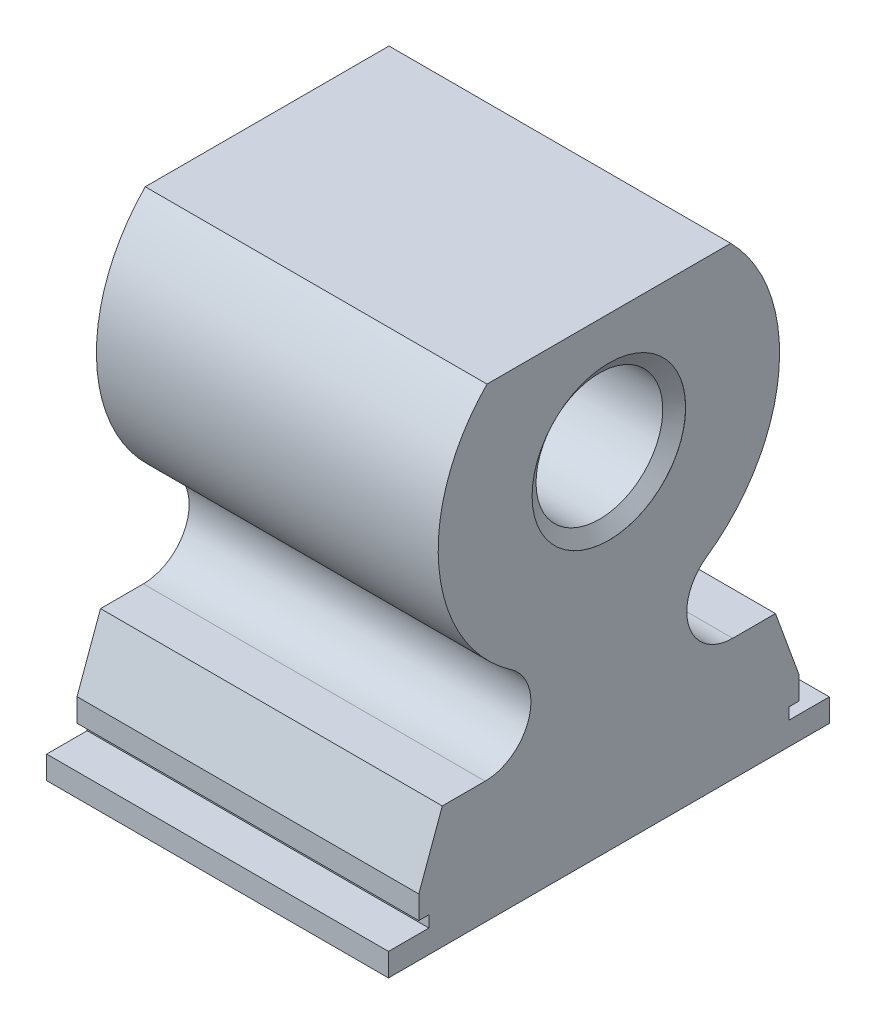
SolidWorks part; units mm, degrees
ref_plane "Plane1" through (0, 0, 0) normal (0, 0, 1) x (1, 0, 0)
ref_plane "Plane2" through (0, 0, 0) normal (0, 1, 0) x (1, 0, 0)
ref_plane "Plane3" through (0, 0, 0) normal (1, 0, 0) x (0, 0, -1)
sketch "BodySke" plane through (0, 0, 0) normal (1, 0, 0) x (0, 0, -1)
  line L0 (-5.74, -9) -> (5.74, -9)
  line L1 (5.74, -9) -> (5.74, -8.4)
  line L2 (5.74, -8.4) -> (4.6867, -8.4)
  line L3 (-5.74, -9) -> (-5.74, -8.4)
  line L4 (-5.74, -8.4) -> (-4.6867, -8.4)
  line L5 (4.6867, -8.4) -> (4.6867, -8.1)
  line L6 (-4.6867, -8.4) -> (-4.6867, -8.1)
  line L7 (4.6867, -8.1) -> (4.95, -8.1)
  line L8 (-4.6867, -8.1) -> (-4.95, -8.1)
  line L9 (-3.2237, -5.82) -> (-4.3385, -5.82)
  line L10 (0, -0.7) -> (4.5045, -0.7) construction
  line L11 (4.3385, -5.82) -> (3.2237, -5.82)
  line L12 (0, 7.62) -> (0, -11.43) construction
  line L13 (7.62, 0) -> (-7.62, 0) construction
  line L14 (2.03, -2.8908) -> (2.03, -7.62) construction
  line L15 (-2.03, -2.8908) -> (-2.03, -7.62) construction
  line L16 (4.3385, -5.82) -> (4.95, -7.5)
  line L17 (4.95, -7.5) -> (4.95, -8.1)
  line L18 (-4.3385, -5.82) -> (-4.95, -7.5)
  line L19 (-4.95, -7.5) -> (-4.95, -8.1)
  circle A0 centre (0, 0) radius 1.65
  arc A1 (2.5412, -3.6469) -> (-2.5412, -3.6469) centre (0, 0) ccw
  arc A2 (3.2237, -5.82) -> (2.5412, -3.6469) centre (3.2237, -4.6263) cw
  arc A3 (-2.5412, -3.6469) -> (-3.2237, -5.82) centre (-3.2237, -4.6263) cw
  dimension "Thread_min" = 3.3
  dimension "C_dia" = 8.89
  dimension "J_dim" = 4.06
  dimension "E_dim" = 11.48
  dimension "D_dim" = 3.18
  dimension "Clinch_ht" = 0.6
  dimension "Side_ht" = 0.6
  dimension "Groove_wid" = 0.3
  dimension "A_dim" = 9.9
  dimension "Groove_overall" = 9.3733
  dimension "F_dim" = 9
  dimension "D12" = 20
  dimension "Advance" = 0.7
extrude "Body" add sketch "BodySke" along normal blind 8.9
revolve "EndChamfer" cut sketch "EndChamferSke" angle 360 about L11
sketch "EndChamferSke" plane through (0, 0, 0) normal (0, 0, 1) x (1, 0, 0)
  line L0 (-0.254, 2) -> (0.0025, 2)
  line L2 (0.0025, 2) -> (0.2475, 1.65)
  line L3 (0.2475, 1.65) -> (-0.254, 1.65)
  line L4 (-0.254, 1.65) -> (-0.254, 2)
  line L5 (9.154, 2) -> (8.8975, 2)
  line L6 (8.8975, 2) -> (8.6525, 1.65)
  line L7 (8.6525, 1.65) -> (9.154, 1.65)
  line L8 (9.154, 1.65) -> (9.154, 2)
  line L9 (0, 4.445) -> (0, -3.6469) construction
  line L10 (8.9, -3.6469) -> (8.9, 4.445) construction
  line L11 (-5.1059, 0) -> (14.0173, 0) construction
  line L12 (8.9, 0) -> (0, 0) construction
  dimension "Inset" = 0.0025
  dimension "D2" = 34.99
  dimension "Inset_far" = 0.0025
  dimension "D3" = 0.254
  dimension "D4" = 0.254
  dimension "Thread_min" = 3.3
  dimension "Thread_nominal" = 4
sketch "ThdSchSke" [suppressed] plane through (0, 0, 0) normal (0, 0, 1) x (1, 0, 0)
  line L0 (-1.2331, 0) -> (11.43, 0) construction
  line L1 (6.0414, 0) -> (0.207, 0) construction
  line L2 (0.0025, 1.7272) -> (0.0025, -1.4224) construction
  line L3 (0.0025, -1.4224) -> (0.2071, -1.1303)
  line L4 (0.207, -1.1303) -> (6.0414, -1.1303) construction
  line L5 (0.0025, -1.4224) -> (-0.202, -1.1303)
  line L6 (-0.202, -1.1303) -> (0.2071, -1.1303)
  line L8 (0.0025, 1.4224) -> (0.0025, -1.4224) construction
  dimension "Vee_angle" = 70
  dimension "Thread_nominal" = 4
revolve "ThreadSchematic" [suppressed] cut sketch "ThdSchSke" angle 360 about L0
pattern_linear "ThdSchPat" [suppressed]
sketch "TopCutSke" plane through (0, 0, 0) normal (-1, 0, 0) x (0, 0, 1)
  line L0 (0, 0) -> (0, 6.35) construction
  line L1 (-4.445, 3.1115) -> (4.445, 3.1115)
  line L2 (-4.445, 3.1115) -> (-4.445, 12.0015)
  line L3 (-4.445, 12.0015) -> (4.445, 12.0015)
  line L4 (4.445, 3.1115) -> (4.445, 12.0015)
  dimension "Width" = 8.89
  dimension "Offset" = 3.1115
extrude "TopCut" cut sketch "TopCutSke" against normal blind 8.9
equation "' \"Length@Body\" = 8.9"
equation "' \"A_dim@BodySke\" = 9.9"
equation "' \"C_dia@BodySke\" = 8.89"
equation "' \"D_dim@BodySke\" = 3.18"
equation "' \"E_dim@BodySke\" = 11.48"
equation "' \"F_dim@BodySke\" = 9"
equation "' \"J_dim@BodySke\" =  4.06"
equation "' \"Advance@BodySke\" = 0.7"
equation "' \"Thread_min@BodySke\" = 3.3"
equation "' \"Thread_nominal@ThreadCosmetic\" = 4"
equation "\"Width@TopCutSke\" = \"C_dia@BodySke\""
equation "\"Offset@TopCutSke\" = \"C_dia@BodySke\" * 0.35"
equation "\"Length@TopCut\" = \"Length@Body\""
equation "\"Clinch_ht@BodySke\" = 1 * 0.6"
equation "\"Groove_wid@BodySke\" = \"Clinch_ht@BodySke\" / 2"
equation "\"Groove_overall@BodySke\" = \"A_dim@BodySke\" - ( \"E_dim@BodySke\" - \"A_dim@BodySke\") / 3"
equation "\"Side_ht@BodySke\" = \"Clinch_ht@BodySke\""
equation "\"Thread_nominal@EndChamferSke\" = \"Thread_nominal@ThreadCosmetic\""
equation "\"Thread_min@EndChamferSke\" = \"Thread_min@BodySke\""
equation "\"D2@EndChamferSke\" = \"Vee_angle@ThdSchSke\" / 2 - 0.01"
equation "\"Thread_nominal@ThdSchSke\" = \"Thread_nominal@ThreadCosmetic\""
equation "\"Num_threads@ThdSchPat\" = int(  ( \"Length@Body\" - \"Inset@EndChamferSke\" - \"Inset_far@EndChamferSke\" ) / \"Advance@BodySke\" + 0.999 )  + 1"
equation "\"Advance@ThdSchPat\" = (  \"Length@Body\" - \"Inset@EndChamferSke\" - \"Inset_far@EndChamferSke\"  ) /  (\"Num_threads@ThdSchPat\" - 1) 'relax it"
